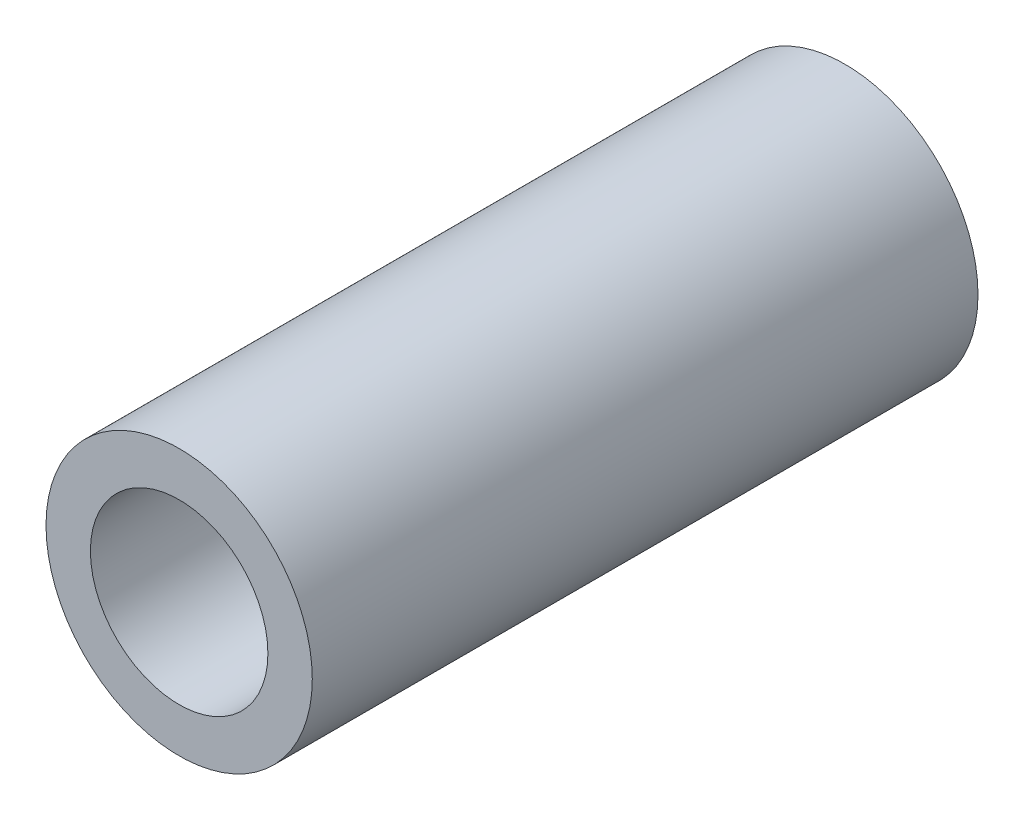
SolidWorks part; units mm, degrees
ref_plane "Plan de face" through (0, 0, 0) normal (0, 0, 1) x (1, 0, 0)
ref_plane "Plan de dessus" through (0, 0, 0) normal (0, 1, 0) x (1, 0, 0)
ref_plane "Plan de droite" through (0, 0, 0) normal (1, 0, 0) x (0, 0, -1)
sketch "Esquisse1" plane through (0, 0, 0) normal (0, 0, 1) x (1, 0, 0)
  circle A0 centre (0, 0) radius 3
  circle A1 centre (0, 0) radius 2
extrude "Extrusion1" add sketch "Esquisse1" along normal blind 15
